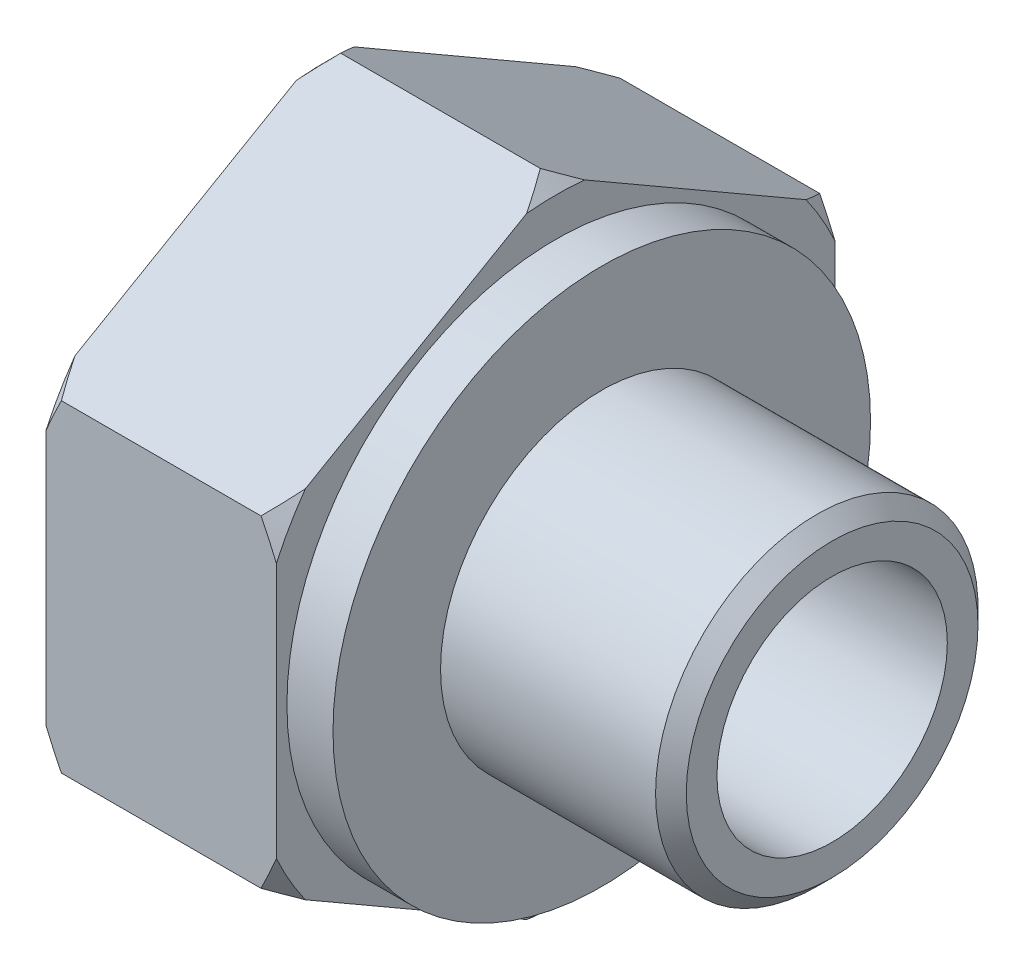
SolidWorks part; units mm, degrees
ref_plane "Face" through (0, 0, 0) normal (0, 0, 1) x (1, 0, 0)
ref_plane "Dessus" through (0, 0, 0) normal (0, 1, 0) x (1, 0, 0)
ref_plane "Droite" through (0, 0, 0) normal (1, 0, 0) x (0, 0, -1)
sketch "Esquisse1" plane through (0, 0, 0) normal (0, 0, 1) x (1, 0, 0)
  line L0 (-49.4342, 0) -> (63.9903, 0) construction
  line L1 (46.2717, 7.5) -> (46.2717, 10.4975)
  line L2 (46.2717, 10.4975) -> (31.2717, 10.4975)
  line L3 (31.2717, 10.4975) -> (31.2717, 17.5)
  line L4 (31.2717, 17.5) -> (28.2717, 17.5)
  line L5 (28.2717, 17.5) -> (28.2717, 21)
  line L6 (28.2717, 21) -> (13.2717, 21)
  line L7 (13.2717, 21) -> (13.2717, 0)
  line L8 (23.2984, 7.5) -> (23.2984, 0)
  line L9 (13.2717, 0) -> (23.2984, 0)
  line L12 (23.2984, 7.5) -> (46.2717, 7.5)
  dimension "D1" = 20.995
  dimension "D2" = 15
  dimension "D3" = 35
  dimension "D4" = 42
  dimension "D7" = 15
  dimension "D8" = 3
  dimension "D9" = 15
revolve "Révolution1" add sketch "Esquisse1" angle 360 about L0
chamfer "Chanfrein1" distance 1 angle 45 3 edges at (13.2717, 0, 21) (28.2717, 0, 21) (46.2717, 0, 10.4975)
sketch "Esquisse2" plane through (13.2717, 0, 0) normal (-1, 0, 0) x (0, 0, 1)
  line L1 (0, 21) -> (-18.1865, 10.5)
  line L2 (-18.1865, 10.5) -> (-18.1865, -10.5)
  line L3 (-18.1865, -10.5) -> (0, -21)
  line L4 (0, -21) -> (18.1865, -10.5)
  line L5 (18.1865, -10.5) -> (18.1865, 10.5)
  line L6 (18.1865, 10.5) -> (0, 21)
  circle A0 centre (0, 0) radius 18.1865 construction
extrude "Enlèv. mat.-Extru.1" cut sketch "Esquisse2" against normal through all flip side to cut
